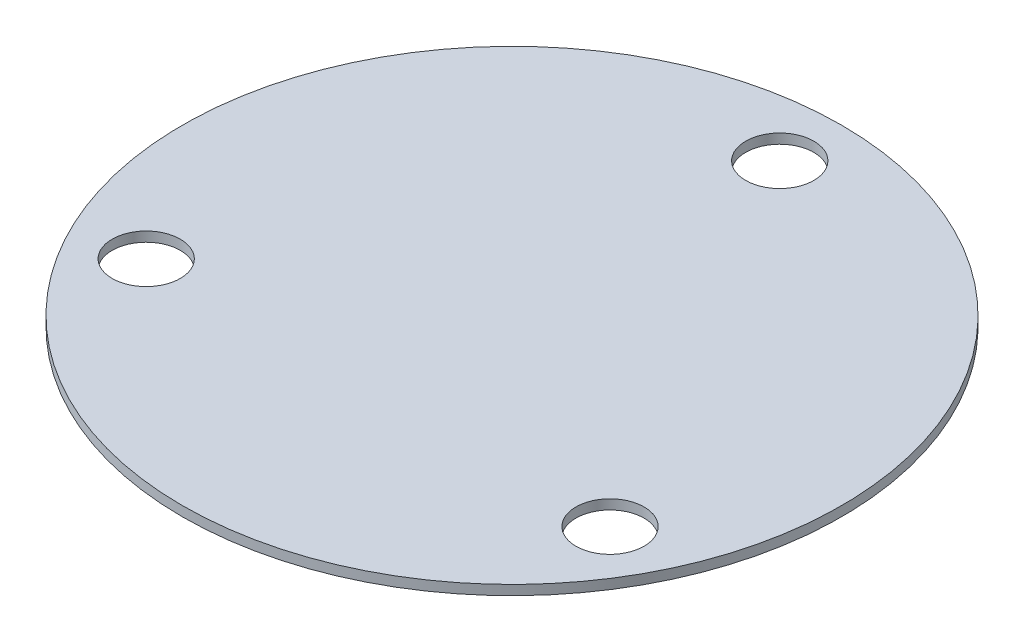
SolidWorks part; units mm, degrees
ref_plane "Front Plane" through (0, 0, 0) normal (0, 0, 1) x (1, 0, 0)
ref_plane "Top Plane" through (0, 0, 0) normal (0, 1, 0) x (1, 0, 0)
ref_plane "Right Plane" through (0, 0, 0) normal (1, 0, 0) x (0, 0, -1)
sketch "Sketch1" plane through (0, 0, 0) normal (0, 1, 0) x (1, 0, 0)
  circle A0 centre (0, 0) radius 101.6
  dimension "D1" = 203.2
extrude "Boss-Extrude1" add sketch "Sketch1" along normal blind 3
sketch "Sketch2" plane through (0, 3, 0) normal (0, 1, 0) x (1, 0, 0)
  line L0 (0, 0) -> (0, 101.6) construction
  line L1 (0, 0) -> (-87.9882, -50.8) construction
  line L2 (0, 0) -> (87.9882, -50.8) construction
  circle A1 centre (0, 0) radius 101.6 construction
  circle A2 centre (0, 82.55) radius 10.5
  circle A3 centre (-71.4904, -41.275) radius 10.5
  circle A4 centre (71.4904, -41.275) radius 10.5
  dimension "D3" = 21
  dimension "D4" = 21
  dimension "D5" = 21
  dimension "D1" = 120
  dimension "D2" = 120
  dimension "D6" = 82.55
  dimension "D7" = 82.55
  dimension "D8" = 82.55
extrude "Cut-Extrude1" cut sketch "Sketch2" against normal blind 10
